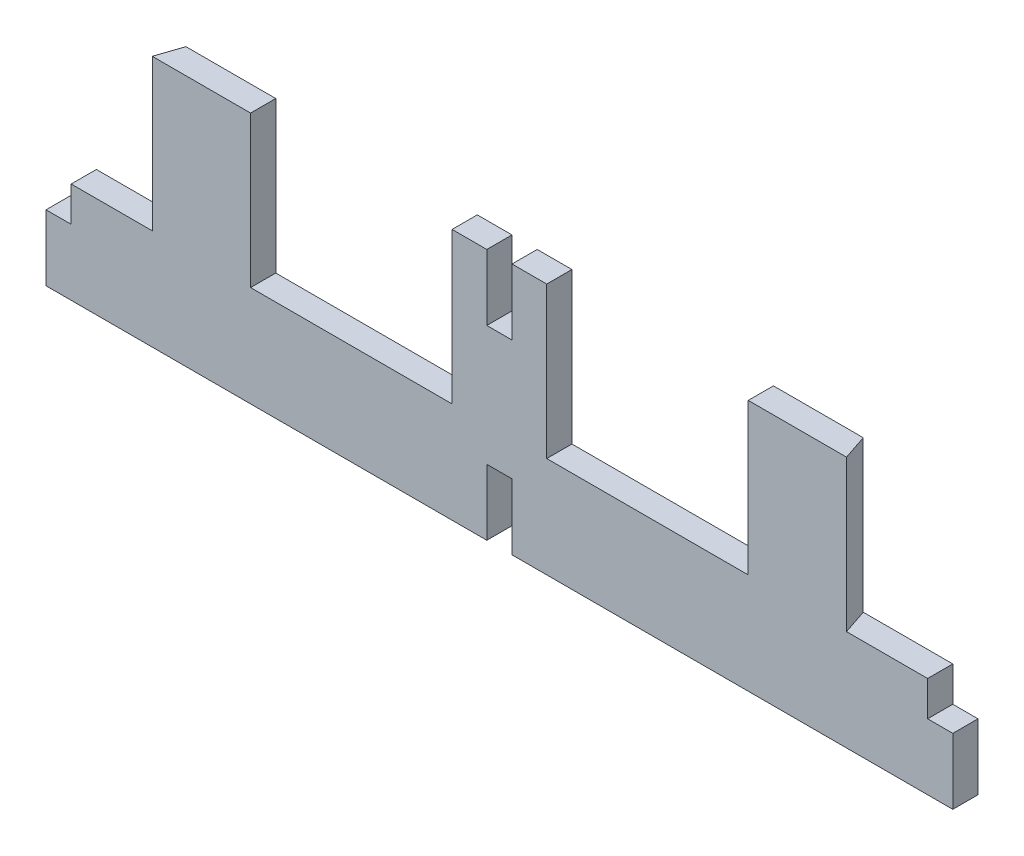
SolidWorks part; units mm, degrees
ref_plane "Front Plane" through (0, 0, 0) normal (0, 0, 1) x (1, 0, 0)
ref_plane "Top Plane" through (0, 0, 0) normal (0, 1, 0) x (1, 0, 0)
ref_plane "Right Plane" through (0, 0, 0) normal (1, 0, 0) x (0, 0, -1)
sketch "Sketch1" plane through (0, 0, 0) normal (0, 0, 1) x (1, 0, 0)
  line L0 (-228.6, 127) -> (228.6, 127) construction
  line L1 (-6.35, 33.1905) -> (-6.35, 0) construction
  line L2 (6.35, 33.1905) -> (6.35, 0) construction
  line L3 (-6.35, 127) -> (-6.35, 93.8095) construction
  line L4 (6.35, 127) -> (6.35, 93.8095) construction
  line L5 (6.35, 33.1905) -> (-6.35, 33.1905) construction
  line L6 (6.35, 93.8095) -> (-6.35, 93.8095) construction
  line L7 (-228.6, 127) -> (-6.35, 127)
  line L8 (-6.35, 33.1905) -> (-6.35, 0)
  line L9 (6.35, 33.1905) -> (6.35, 0)
  line L10 (-6.35, 127) -> (-6.35, 93.8095)
  line L11 (6.35, 127) -> (6.35, 93.8095)
  line L12 (6.35, 33.1905) -> (-6.35, 33.1905)
  line L13 (6.35, 93.8095) -> (-6.35, 93.8095)
  line L14 (6.35, 127) -> (228.6, 127)
  line L15 (6.35, 0) -> (228.6, 0)
  line L16 (228.6, 0) -> (228.6, 33.1905)
  line L17 (215.9, 93.8095) -> (215.9, 33.1905)
  line L18 (215.9, 33.1905) -> (228.6, 33.1905)
  line L19 (215.9, 93.8095) -> (228.6, 93.8095)
  line L20 (228.6, 93.8095) -> (228.6, 127)
  line L21 (-6.35, 0) -> (-228.6, 0)
  line L22 (-228.6, 0) -> (-228.6, 33.1905)
  line L23 (-228.6, 93.8095) -> (-215.9, 93.8095)
  line L24 (-215.9, 93.8095) -> (-215.9, 33.1905)
  line L25 (-215.9, 33.1905) -> (-228.6, 33.1905)
  line L26 (-228.6, 93.8095) -> (-228.6, 127)
  dimension "D1" = 12.7
  dimension "D2" = 12.7
extrude "Extrude1" add sketch "Sketch1" along normal blind 12.7
sketch "Sketch4" plane through (0, 127, 0) normal (0, 1, 0) x (1, 0, 0)
  line L0 (228.6, 0) -> (6.35, 0) construction
  line L1 (23.8592, 0) -> (125.4592, 0)
  line L2 (23.8592, 0) -> (23.8592, -12.7)
  line L3 (23.8592, -12.7) -> (125.4592, -12.7)
  line L4 (125.4592, 0) -> (125.4592, -12.7)
  line L5 (228.6, -12.7) -> (6.35, -12.7) construction
  line L6 (23.8592, 63.5) -> (23.8592, -12.7) construction
  line L7 (125.4592, -12.7) -> (125.4592, 63.5) construction
  line L8 (-6.35, 0) -> (-228.6, 0) construction
  line L9 (-125.4592, 0) -> (-23.8592, 0)
  line L10 (-125.4592, 0) -> (-125.4592, -12.7)
  line L11 (-125.4592, -12.7) -> (-23.8592, -12.7)
  line L12 (-23.8592, 0) -> (-23.8592, -12.7)
  line L13 (-6.35, -12.7) -> (-228.6, -12.7) construction
  line L14 (-23.8592, -12.7) -> (-23.8592, 63.5) construction
  line L15 (-125.4592, 63.5) -> (-125.4592, -12.7) construction
  line L17 (-228.6, 0) -> (-228.6, -12.7)
  line L18 (-228.6, -12.7) -> (-175.0098, -12.7)
  line L19 (-175.0098, -12.7) -> (-153.185, 52.2635) construction
  line L20 (-175.0098, -12.7) -> (-170.7432, 0)
  line L21 (-170.7432, 0) -> (-228.6, 0)
  line L22 (175.0098, -12.7) -> (228.6, -12.7)
  line L23 (153.185, 52.2635) -> (175.0098, -12.7) construction
  line L24 (228.6, -12.7) -> (228.6, 0)
  line L25 (228.6, 0) -> (170.7432, 0)
  line L26 (170.7432, 0) -> (175.0098, -12.7)
extrude "Cut-Extrude3" cut sketch "Sketch4" against normal blind 76.2
